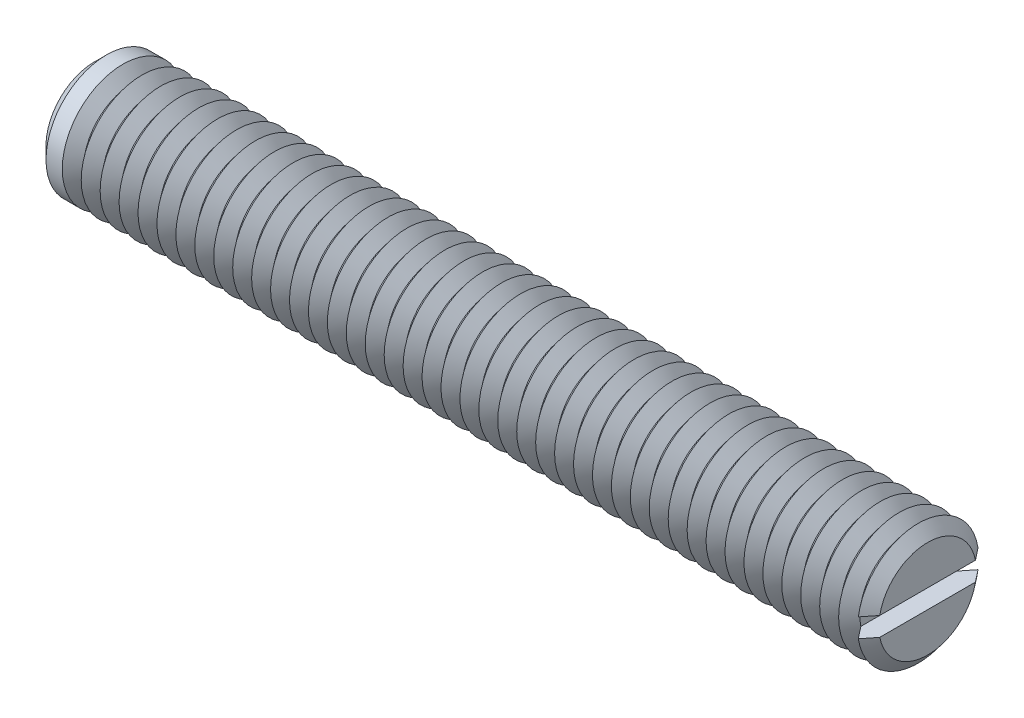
SolidWorks part; units mm, degrees
ref_plane "Front Plane" through (0, 0, 0) normal (0, 0, 1) x (1, 0, 0)
ref_plane "Top Plane" through (0, 0, 0) normal (0, 1, 0) x (1, 0, 0)
ref_plane "Right Plane" through (0, 0, 0) normal (1, 0, 0) x (0, 0, -1)
sketch "Sketch1" plane through (0, 0, 0) normal (1, 0, 0) x (0, 0, -1)
  circle A0 centre (0, 0) radius 4
  dimension "D1" = 8
extrude "Extrude1" add sketch "Sketch1" along normal mid plane 55
sketch "Sketch2" plane through (0, 0, 0) normal (0, 0, 1) x (1, 0, 0)
  line L0 (27.5, 0.625) -> (26.25, 0.625)
  line L1 (27.5, -4) -> (27.5, 4) construction
  line L2 (26.25, 0.625) -> (26.25, -0.625)
  line L3 (0, 0) -> (50000, 0) construction
  line L4 (27.5, -0.625) -> (26.25, -0.625)
  line L5 (27.5, -0.625) -> (27.5, 0.625)
  point P9 (26.25, 0)
  dimension "D1" = 1.25
extrude "Extrude2" cut sketch "Sketch2" against normal mid plane 12
chamfer "Chamfer1" distance 0.8 angle 45 1 edges at (-27.5, 0, -4)
sketch "Sketch3" plane through (0, 0, 0) normal (0, 0, 1) x (1, 0, 0)
  line L0 (0, 0) -> (30.9602, 0) construction
  line L1 (26.875, -4) -> (28.125, -4)
  line L2 (-26.7, -4) -> (27.5, -4) construction
  line L3 (28.125, -4) -> (27.5, -3.2194)
  line L4 (27.5, -4) -> (27.5, -0.625) construction
  line L5 (27.5, -3.2194) -> (26.875, -4)
  dimension "D1" = 1.25
  dimension "D2" = 1
revolve "Cut-Revolve1" cut sketch "Sketch3" angle 360 about L0
pattern_linear "LPattern1" count 43 spacing 1.25 along (-1, 0, 0) of "Cut-Revolve1"
equation "\"D2@Sketch3\" = \"D1@Sketch3\"*0.8"
